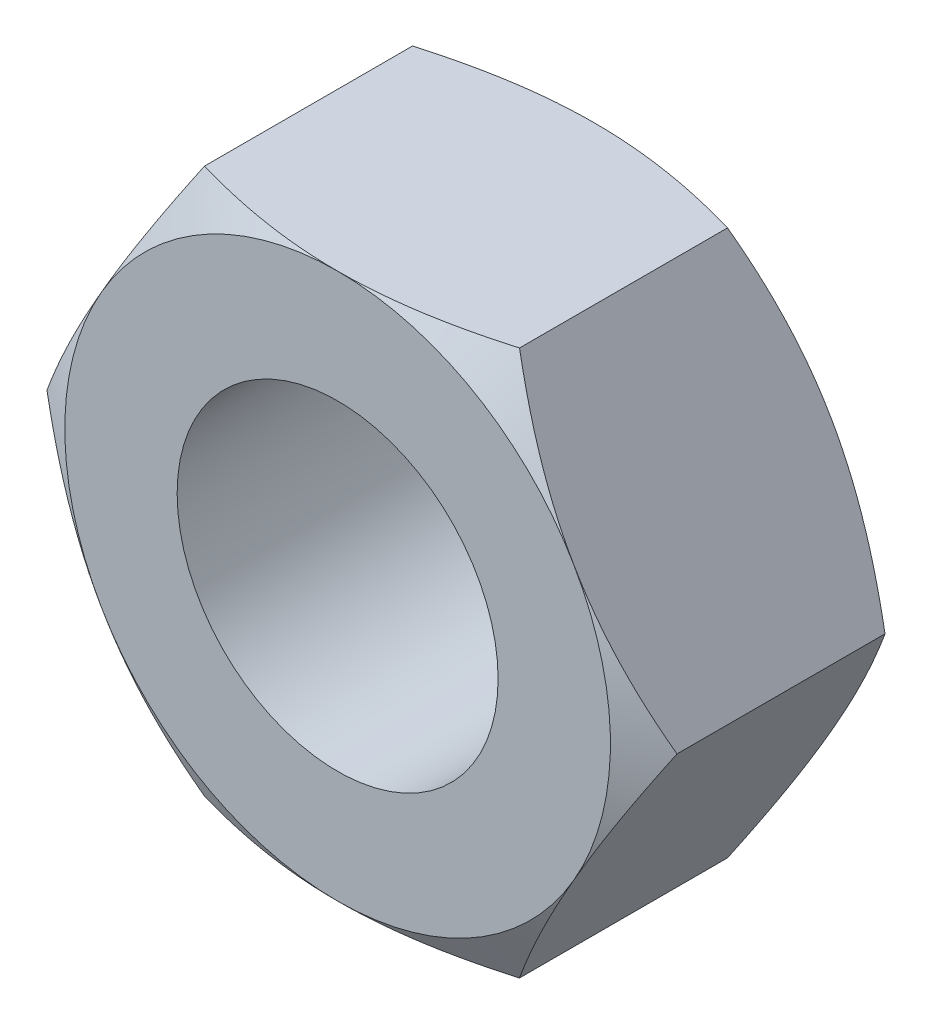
SolidWorks part; units mm, degrees
ref_plane "Plan1" through (0, 0, 0) normal (0, 0, 1) x (1, 0, 0)
ref_plane "Plan2" through (0, 0, 0) normal (0, 1, 0) x (1, 0, 0)
ref_plane "Plan3" through (0, 0, 0) normal (1, 0, 0) x (0, 0, -1)
sketch "Esquisse1" plane through (0, 0, 0) normal (0, 0, 1) x (1, 0, 0)
  line L0 (-4.9075, -8.5) -> (-9.815, 0)
  line L1 (4.9075, -8.5) -> (-4.9075, -8.5)
  line L2 (9.815, 0) -> (4.9075, -8.5)
  line L3 (-9.815, 0) -> (-4.9075, 8.5)
  line L4 (-4.9075, 8.5) -> (4.9075, 8.5)
  line L5 (4.9075, 8.5) -> (9.815, 0)
  circle A0 centre (0, 0) radius 5
  dimension "D6" = 10
  dimension "D1" = 8.5
  dimension "D2" = 8.5
  dimension "D3" = 8.5
  dimension "D4" = 8.5
  dimension "D5" = 8.5
extrude "Base-Extrusion" add sketch "Esquisse1" along normal mid plane 8
sketch "Esquisse2" plane through (0, 0, -4) normal (0, 0, -1) x (-1, 0, 0)
  line L0 (-4.9075, 8.5) -> (-9.815, 0) construction
  circle A0 centre (0, 0) radius 12.0614
  circle A1 centre (0, 0) radius 8.5
extrude "Enlèv. mat.-Extru.1" cut sketch "Esquisse2" against normal blind 5 draft 60
sketch "Esquisse3" plane through (0, 0, 4) normal (0, 0, 1) x (1, 0, 0)
  line L0 (7.3612, 4.25) -> (4.9075, 8.5) construction
  circle A0 centre (0, 0) radius 8.5
  circle A1 centre (0, 0) radius 13.4715
extrude "Enlèv. mat.-Extru.2" cut sketch "Esquisse3" against normal blind 5 draft 60
